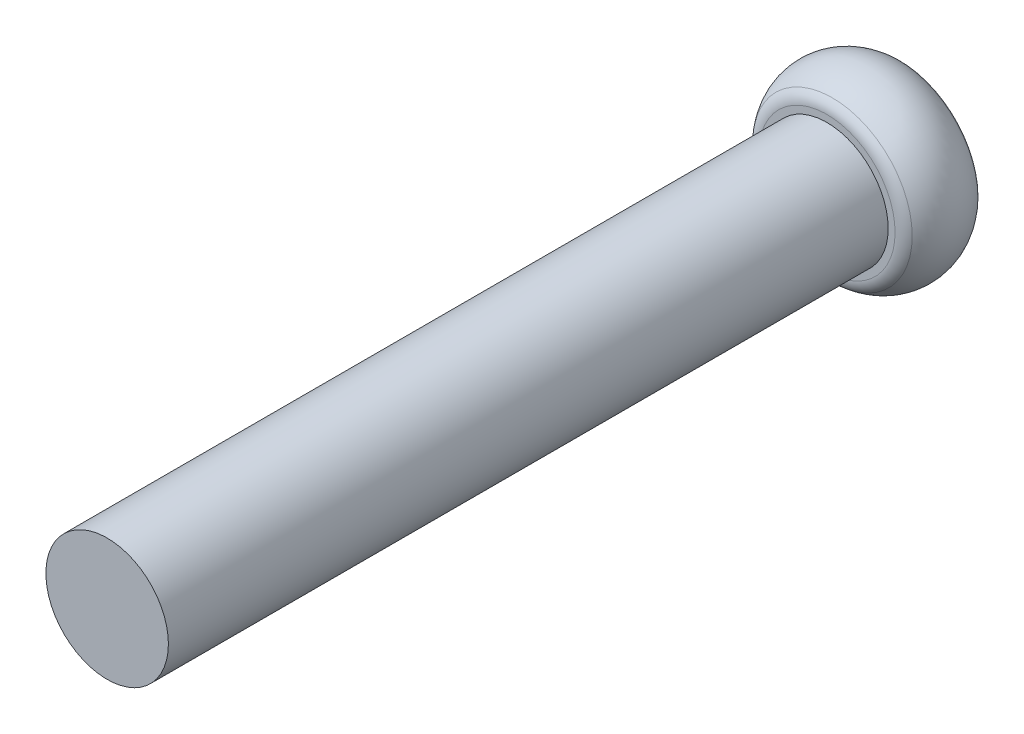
SolidWorks part; units mm, degrees
ref_plane "Front Plane" through (0, 0, 0) normal (0, 0, 1) x (1, 0, 0)
ref_plane "Top Plane" through (0, 0, 0) normal (0, 1, 0) x (1, 0, 0)
ref_plane "Right Plane" through (0, 0, 0) normal (1, 0, 0) x (0, 0, -1)
sketch "Sketch1" plane through (0, 0, 0) normal (1, 0, 0) x (0, 0, -1)
  line L0 (-15.0531, 0) -> (10.9469, 0) construction
  line L1 (8.4469, 2) -> (-15.0531, 2)
  line L2 (-15.0531, 2) -> (-15.0531, 0)
  line L3 (10.9469, 0) -> (10.9469, 2.2259)
  line L4 (8.4469, 2) -> (8.4469, 2.2259)
  line L5 (6.9469, 3) -> (10.9469, 3) construction
  line L6 (-15.0531, 0) -> (10.9469, 0)
  line L7 (9.6969, 3) -> (9.6969, 1.3369) construction
  arc A0 (8.6245, 2.6081) -> (10.7693, 2.6081) centre (9.6969, 1.3369) cw
  arc A1 (10.9469, 2.2259) -> (10.7693, 2.6081) centre (10.4469, 2.2259) ccw
  arc A2 (8.6245, 2.6081) -> (8.4469, 2.2259) centre (8.9469, 2.2259) ccw
  dimension "D5" = 0.5
  dimension "D1" = 26
  dimension "D2" = 2
  dimension "D3" = 3
  dimension "D4" = 2.5
revolve "Revolve1" add sketch "Sketch1" angle 360 about L6
sketch "Sketch2" plane through (0, 0, -10.9469) normal (0, 0, -1) x (-1, 0, 0)
  line L0 (0, 0) -> (0, 2) construction
  line L1 (0, 0) -> (1.4142, 1.4142) construction
  line L2 (0, 0) -> (2, 0) construction
  line L3 (0, 0) -> (1.4142, -1.4142) construction
  line L4 (0, 0) -> (0, -2) construction
  line L5 (0, 0) -> (-1.4142, -1.4142) construction
  line L6 (0, 0) -> (-2, 0) construction
  line L7 (0, 0) -> (-1.4142, 1.4142) construction
  line L8 (0, 2) -> (1.4142, 1.4142)
  line L9 (1.4142, 1.4142) -> (2, 0)
  line L10 (2, 0) -> (1.4142, -1.4142)
  line L11 (1.4142, -1.4142) -> (0, -2)
  line L12 (0, -2) -> (-1.4142, -1.4142)
  line L13 (-1.4142, -1.4142) -> (-2, 0)
  line L14 (-2, 0) -> (-1.4142, 1.4142)
  line L15 (-1.4142, 1.4142) -> (0, 2)
  circle A0 centre (0, 0) radius 2 construction
  point P13 (0, 0)
  dimension "D1" = 4
  dimension "D2" = 8
extrude "Cut-Extrude1" cut sketch "Sketch2" against normal blind 1.5
